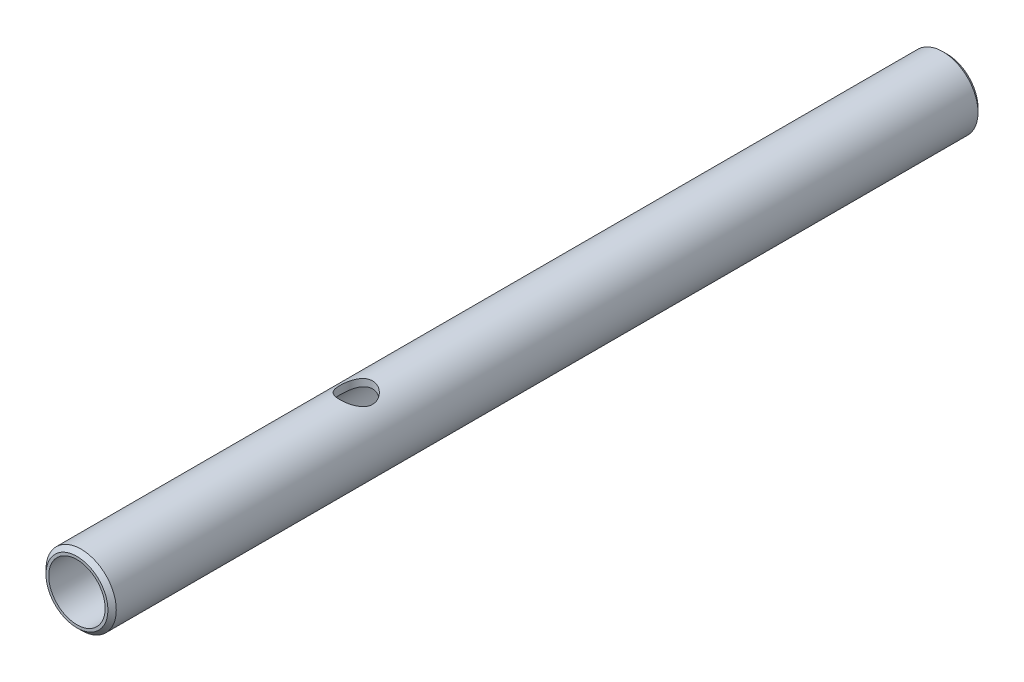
SolidWorks part; units mm, degrees
ref_plane "Front Plane" through (0, 0, 0) normal (0, 0, 1) x (1, 0, 0)
ref_plane "Top Plane" through (0, 0, 0) normal (0, 1, 0) x (1, 0, 0)
ref_plane "Right Plane" through (0, 0, 0) normal (1, 0, 0) x (0, 0, -1)
sketch "Sketch1" plane through (0, 0, 0) normal (0, 0, 1) x (1, 0, 0)
  circle A0 centre (0, 0) radius 10.668
  circle A1 centre (0, 0) radius 8.5598
  dimension "D1" = 21.336
  dimension "D2" = 17.1196
extrude "Boss-Extrude1" add sketch "Sketch1" along normal blind 263.906
chamfer "Chamfer1" distance 1.27 angle 45 2 edges at (10.668, 0, 0) (10.668, 0, 263.906)
sketch "Sketch2" plane through (0, 0, 0) normal (0, 1, 0) x (1, 0, 0)
  circle A0 centre (0, -179.197) radius 4.9606
  dimension "D1" = 9.9212
extrude "Cut-Extrude1" cut sketch "Sketch2" along normal through all
